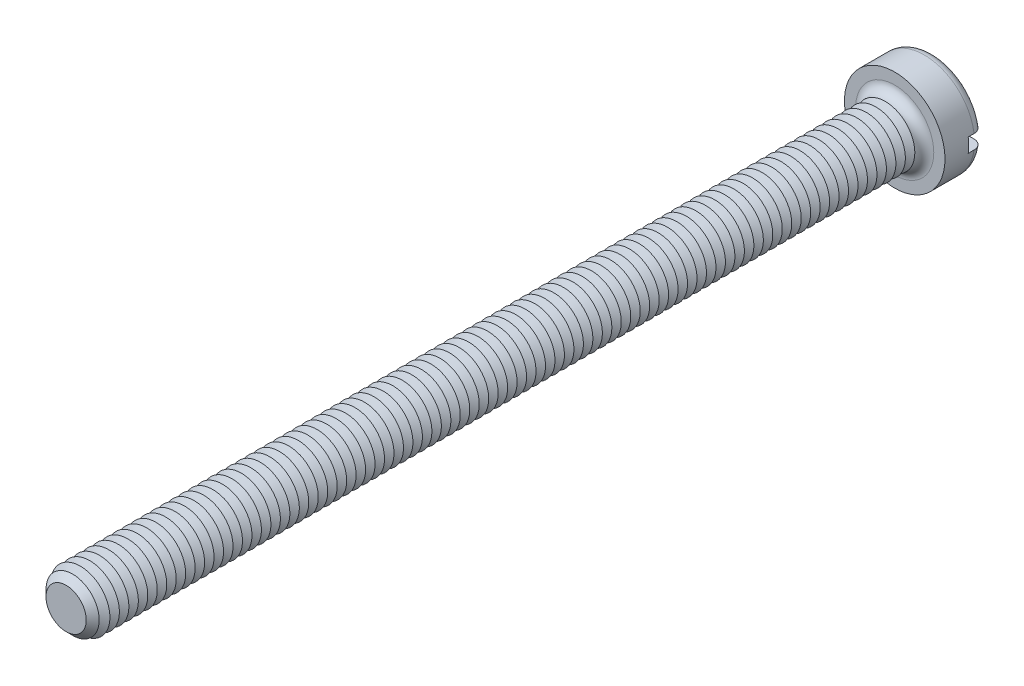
SolidWorks part; units mm, degrees
ref_plane "Front Plane" through (0, 0, 0) normal (0, 0, 1) x (1, 0, 0)
ref_plane "Top Plane" through (0, 0, 0) normal (0, 1, 0) x (1, 0, 0)
ref_plane "Right Plane" through (0, 0, 0) normal (1, 0, 0) x (0, 0, -1)
sketch "Sketch3" plane through (0, 0, 0) normal (0, 0, 1) x (1, 0, 0)
  circle A0 centre (0, 0) radius 4.25
  dimension "D1" = 8.5
extrude "Boss-Extrude2" add sketch "Sketch3" against normal blind 3.3
sketch "Sketch4" plane through (0, 0, 0) normal (0, 0, 1) x (1, 0, 0)
  circle A0 centre (0, 0) radius 2.5
  dimension "D1" = 5
extrude "Boss-Extrude3" add sketch "Sketch4" along normal blind 70
fillet "Fillet1" radius 0.8 2 edges at (4.25, 0, -3.3) (2.5, 0, 0)
chamfer "Chamfer1" distance 0.8 angle 45 1 edges at (2.5, 0, 70)
sketch "Sketch5" plane through (0, 0, 0) normal (1, 0, 0) x (0, 0, -1)
  line L0 (1.6944, 0) -> (-7.6738, 0) construction
sketch "Sketch6" plane through (0, 0, 0) normal (1, 0, 0) x (0, 0, -1)
  line L0 (-0.8, 2.5) -> (-1.2, 1.8072)
  line L1 (-1.2, 1.8072) -> (-1.6, 2.5)
  line L2 (-0.8, 2.5) -> (-69.2, 2.5) construction
  line L3 (-1.6, 2.5) -> (-0.8, 2.5)
  dimension "D1" = 0.8
revolve "Cut-Revolve1" cut sketch "Sketch6" angle 360 about L0
pattern_linear "LPattern1" count 86 spacing 0.8 along (0, 0, 1) of "Cut-Revolve1"
sketch "Sketch8" plane through (0, 0, -3.3) normal (0, 0, -1) x (-1, 0, 0)
  line L1 (4.25, -0.6) -> (-4.25, -0.6)
  line L2 (4.25, -0.6) -> (4.25, 0.6)
  line L3 (4.25, 0.6) -> (-4.25, 0.6)
  line L4 (-4.25, -0.6) -> (-4.25, 0.6)
  line L5 (4.25, -0.6) -> (-4.25, 0.6) construction
  line L6 (4.25, 0.6) -> (-4.25, -0.6) construction
  point P0 (0, 0)
  dimension "D1" = 8.5
  dimension "D2" = 1.2
extrude "Cut-Extrude1" cut sketch "Sketch8" against normal blind 1.3
